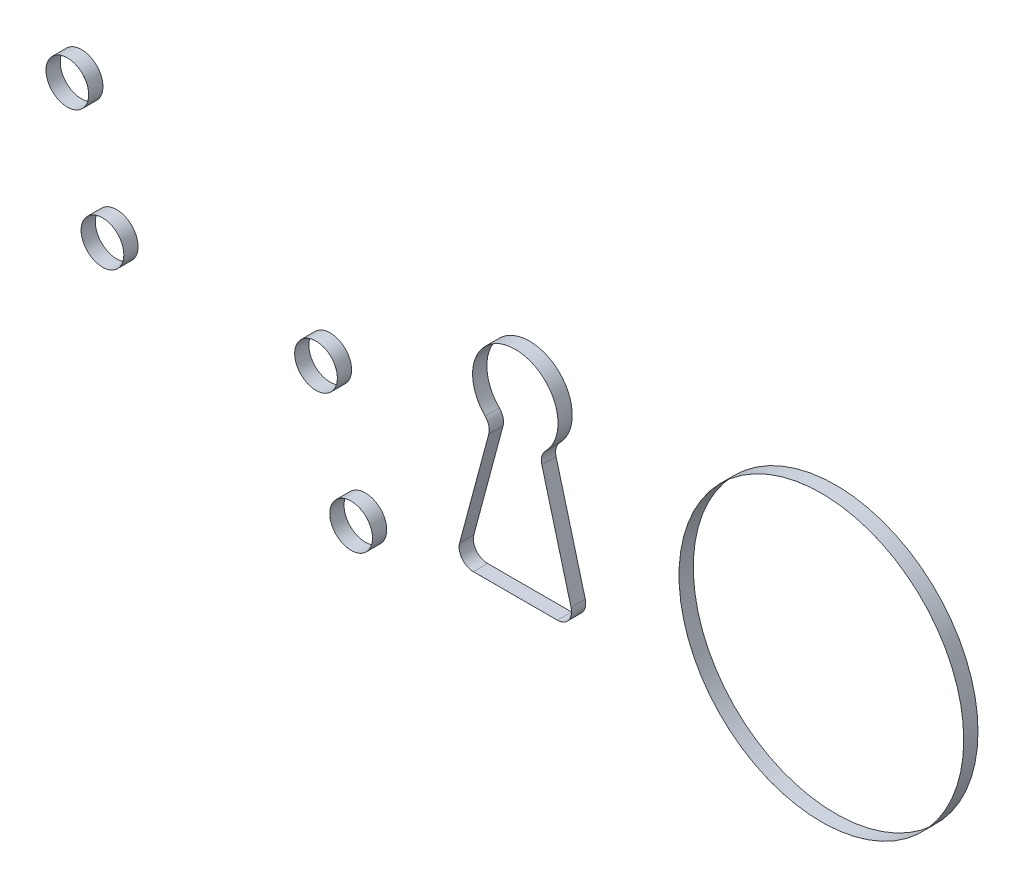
SolidWorks part; units mm, degrees
ref_plane "Plan de face" through (0, 0, 0) normal (0, 0, 1) x (1, 0, 0)
ref_plane "Plan de dessus" through (0, 0, 0) normal (0, 1, 0) x (1, 0, 0)
ref_plane "Plan de droite" through (0, 0, 0) normal (1, 0, 0) x (0, 0, -1)
sketch "Esquisse1" plane through (0, 0, 0) normal (0, 0, 1) x (1, 0, 0)
  line L3 (25.4134, -5.7412) -> (23.3625, 1.9128)
  line L4 (19.6375, 1.9128) -> (17.5866, -5.7412)
  line L5 (18.5526, -7) -> (24.4474, -7)
  line L6 (25.4134, -5.7412) -> (23.3625, 1.9128)
  line L7 (19.6375, 1.9128) -> (17.5866, -5.7412)
  line L8 (18.5526, -7) -> (24.4474, -7)
  circle A1 centre (7.5, 0) radius 1.5
  circle A2 centre (7.5, 0) radius 1.5
  circle A3 centre (-7.5, 0) radius 1.5
  circle A4 centre (-7.5, 0) radius 1.5
  circle A5 centre (9.9679, -8.5) radius 1.5
  circle A6 centre (9.9679, -8.5) radius 1.5
  circle A7 centre (-9.9679, 8.5) radius 1.5
  circle A8 centre (-9.9679, 8.5) radius 1.5
  circle A9 centre (43, 0) radius 10
  circle A10 centre (43, 0) radius 10
  arc A15 (23.6213, 2.8787) -> (23.3625, 1.9128) centre (24.3284, 2.1716) ccw
  arc A16 (23.6213, 2.8787) -> (19.3787, 2.8787) centre (21.5, 5) ccw
  arc A17 (19.6375, 1.9128) -> (19.3787, 2.8787) centre (18.6716, 2.1716) ccw
  arc A18 (17.5866, -5.7412) -> (18.5526, -7) centre (18.5526, -6) ccw
  arc A19 (24.4474, -7) -> (25.4134, -5.7412) centre (24.4474, -6) ccw
  arc A20 (23.6213, 2.8787) -> (23.3625, 1.9128) centre (24.3284, 2.1716) ccw
  arc A21 (23.6213, 2.8787) -> (19.3787, 2.8787) centre (21.5, 5) ccw
  arc A22 (19.6375, 1.9128) -> (19.3787, 2.8787) centre (18.6716, 2.1716) ccw
  arc A23 (17.5866, -5.7412) -> (18.5526, -7) centre (18.5526, -6) ccw
  arc A24 (24.4474, -7) -> (25.4134, -5.7412) centre (24.4474, -6) ccw
  dimension "D1" = 0
  dimension "D2" = 0
  dimension "D3" = 0
  dimension "D4" = 0
  dimension "D5" = 0
  dimension "D6" = 0
extrude "Extru.-Mince1" add sketch "Esquisse1" along normal blind 1 thin
sketch "Esquisse2" plane through (0, 0, 0) normal (0, 0, 1) x (1, 0, 0)
  point P0 (25.3, -0.05)
  dimension "D1" = 25.3
  dimension "D2" = 0.05
